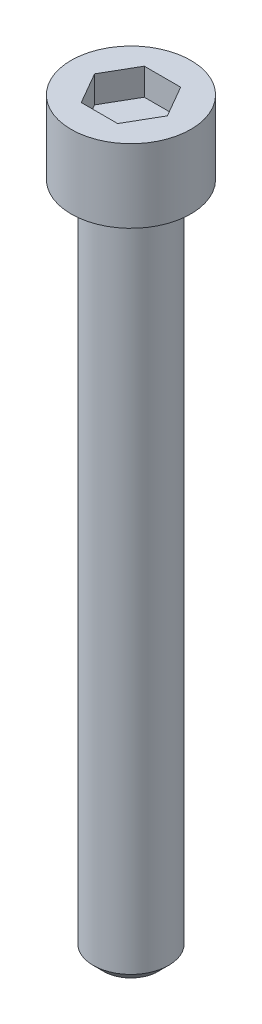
SolidWorks part; units mm, degrees
ref_plane "Front" through (0, 0, 0) normal (0, 0, 1) x (1, 0, 0)
ref_plane "Top" through (0, 0, 0) normal (0, 1, 0) x (1, 0, 0)
ref_plane "Right" through (0, 0, 0) normal (1, 0, 0) x (0, 0, -1)
sketch "Sketch1" plane through (0, 0, 0) normal (0, 0, 1) x (1, 0, 0)
  line L0 (0, 2.7686) -> (2.2606, 2.7686)
  line L2 (2.2606, 2.7686) -> (2.2606, 0)
  line L3 (2.2606, 0) -> (1.4224, 0)
  line L4 (1.4224, 0) -> (1.4224, -25.0031)
  line L5 (1.4224, -25.0031) -> (1.0255, -25.4)
  line L6 (1.0255, -25.4) -> (0, -25.4)
  line L7 (0, -25.4) -> (0, 2.7686)
  line L8 (0, 17.272) -> (0, -24.892) construction
  dimension "Pitch" = 0.3969
  dimension "D2" = 45
  dimension "Diam" = 2.8448
  dimension "Head Dia" = 4.5212
  dimension "Thick" = 2.7686
  dimension "Length" = 25.4
revolve "Base-Revolve" add sketch "Sketch1" angle 360 about L8
sketch "Sketch2" plane through (0, 2.7686, 0) normal (0, 1, 0) x (-1, 0, 0)
  line L1 (-1.3748, 0) -> (-0.6874, -1.1906)
  line L2 (-0.6874, -1.1906) -> (0.6874, -1.1906)
  line L3 (0.6874, -1.1906) -> (1.3748, 0)
  line L4 (1.3748, 0) -> (0.6874, 1.1906)
  line L5 (0.6874, 1.1906) -> (-0.6874, 1.1906)
  line L6 (-0.6874, 1.1906) -> (-1.3748, 0)
  circle A0 centre (0, 0) radius 1.1906 construction
  dimension "HexK" = 2.3813
extrude "Cut-Extrude1" cut sketch "Sketch2" against normal blind 1.016
